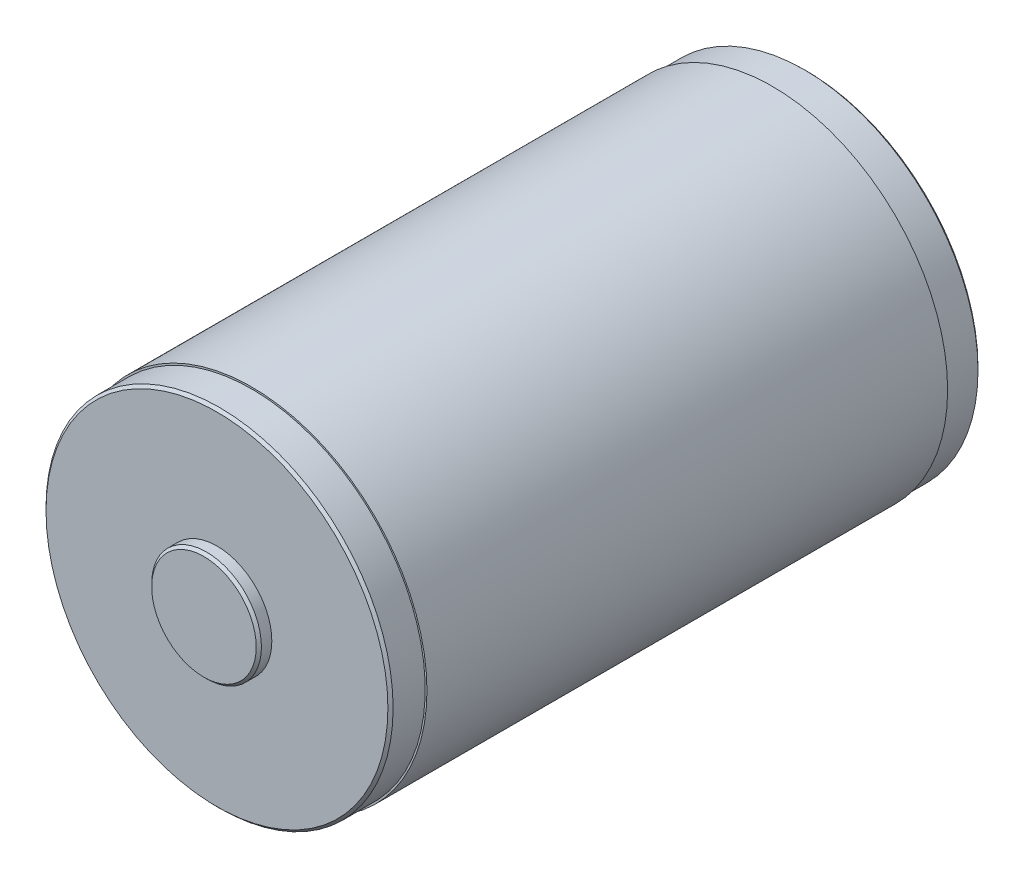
SolidWorks part; units mm, degrees
other "<217-3351>-<Imported1>"
ref_plane "Front Plane" through (0, 0, 0) normal (0, 0, 1) x (1, 0, 0)
ref_plane "Top Plane" through (0, 0, 0) normal (0, 1, 0) x (1, 0, 0)
ref_plane "Right Plane" through (0, 0, 0) normal (1, 0, 0) x (0, 0, -1)
mirrored part "217-3351_Mirrored"
